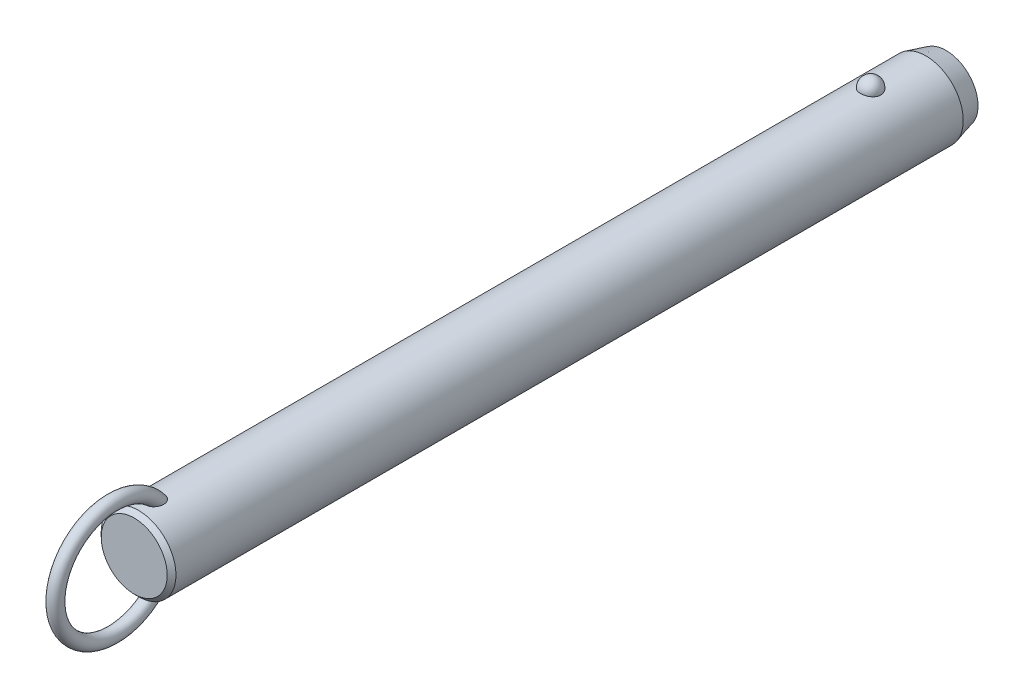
SolidWorks part; units mm, degrees
ref_plane "Front Plane" through (0, 0, 0) normal (0, 0, 1) x (1, 0, 0)
ref_plane "Top Plane" through (0, 0, 0) normal (0, 1, 0) x (1, 0, 0)
ref_plane "Right Plane" through (0, 0, 0) normal (1, 0, 0) x (0, 0, -1)
sketch "Sketch2" plane through (0, 0, 0) normal (0, 0, 1) x (1, 0, 0)
  circle A0 centre (0, 0) radius 11.1
  point P3 (0, 11.1)
  dimension "D1" = 22.2
extrude "Boss-Extrude1" add sketch "Sketch2" along normal blind 203
sketch "Sketch3" plane through (0, 0, 0) normal (0, 0, -1) x (-1, 0, 0)
  circle A0 centre (0, 0) radius 11.1
  dimension "D1" = 22.2
extrude "Boss-Extrude2" add sketch "Sketch3" along normal blind 25.4
chamfer "Chamfer1" distance 6 angle 15 1 edges at (-11.1, 0, -25.4)
sketch "Sketch12" plane through (0, 0, 0) normal (1, 0, 0) x (0, 0, -1)
  line L0 (-203, 11.1) -> (-203, -11.1) construction
  point P0 (-203, 0)
sketch "Sketch13" plane through (0, 0, 0) normal (1, 0, 0) x (0, 0, -1)
  circle A0 centre (-222.05, 0) radius 19.05
  point P2 (-203, 0)
  dimension "D1" = 38.1
sketch "Sketch14" plane through (0, 0, 0) normal (0, 1, 0) x (1, 0, 0)
  circle A0 centre (0, -205) radius 2
  point P2 (0, -203)
  dimension "D1" = 4
sweep "Sweep1" add profiles "Sketch14" path "Sketch13"
sketch "Sketch15" plane through (0, 0, 203) normal (0, 0, 1) x (1, 0, 0)
  circle A0 centre (0, 0) radius 11.1
  dimension "D1" = 22.2
extrude "Boss-Extrude3" add sketch "Sketch15" along normal blind 12.7
chamfer "Chamfer2" distance 1.3 angle 45 1 edges at (11.1, 0, 215.7)
sketch "Sketch18" plane through (0, 0, 0) normal (1, 0, 0) x (0, 0, -1)
  line L0 (19.4, 11.1) -> (-206.568, 11.1) construction
  line L1 (3, 14.1) -> (3, 8.1)
  line L2 (-206.568, -11.1) -> (19.4, -11.1) construction
  arc A0 (3, 14.1) -> (3, 8.1) centre (3, 11.1) ccw
  point P4 (0, 11.1)
  dimension "D1" = 25.2
revolve "Revolve1" add sketch "Sketch18" angle 360 about L1
